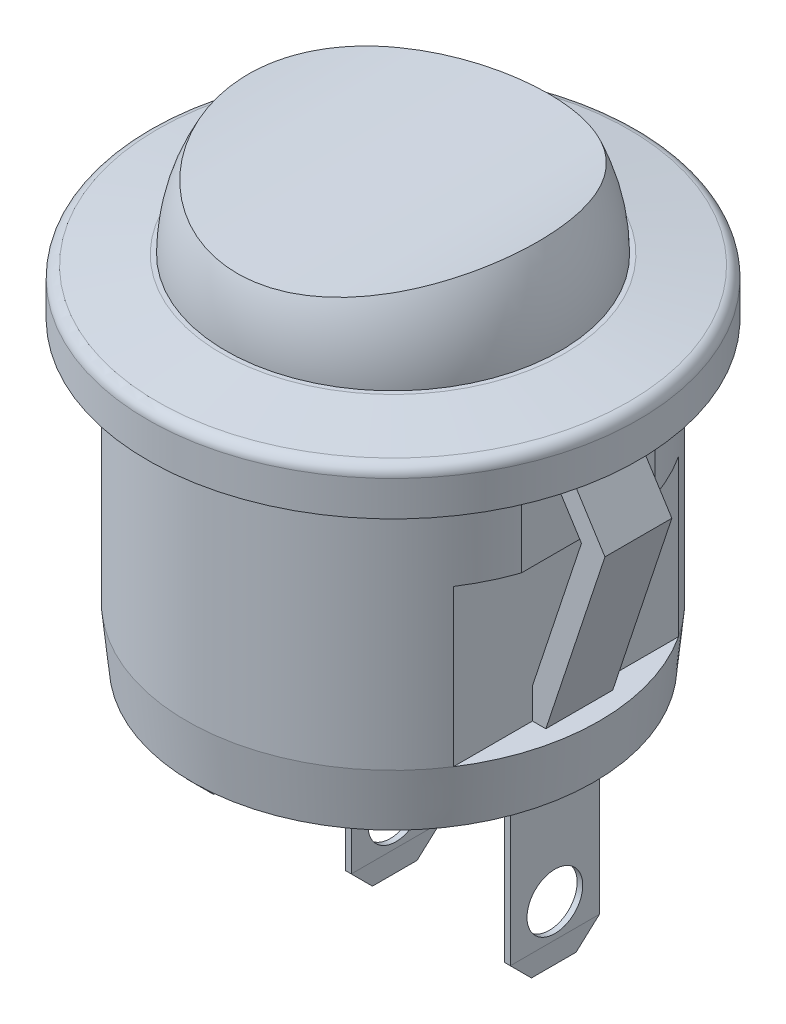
SolidWorks part; units mm, degrees
ref_plane "Front Plane" through (0, 0, 0) normal (0, 0, 1) x (1, 0, 0)
ref_plane "Top Plane" through (0, 0, 0) normal (0, 1, 0) x (1, 0, 0)
ref_plane "Right Plane" through (0, 0, 0) normal (1, 0, 0) x (0, 0, -1)
sketch "Sketch1" plane through (0, 0, 0) normal (0, 0, 1) x (1, 0, 0)
  line L0 (0, 0) -> (-9.25, 0)
  line L1 (-9.25, 0) -> (-9.25, 13.5)
  line L2 (-9.25, 13.5) -> (-11, 13.5)
  line L3 (-11, 13.5) -> (-11, 16)
  line L4 (-11, 16) -> (0, 16)
  line L5 (0, 16) -> (0, 0)
  dimension "D1" = 9.25
  dimension "D2" = 16
  dimension "D3" = 11
  dimension "D4" = 2.5
revolve "Revolve1" add sketch "Sketch1" angle 360 about L5
sketch "Sketch2" plane through (0, 0, 0) normal (0, 0, 1) x (1, 0, 0)
  line L0 (11, 16) -> (-11, 16) construction
  line L1 (11, 16) -> (-11, 16) construction
  line L2 (-7.5, 16) -> (7.5, 16) construction
  line L3 (0, 16) -> (0, 23.5) construction
  line L4 (0, 16) -> (-7.5, 16)
  line L5 (0, 23.5) -> (0, 16)
  arc A0 (0, 23.5) -> (-7.5, 16) centre (0, 16) ccw
  dimension "D1" = 15
revolve "Revolve2" add sketch "Sketch2" angle 360 about L5
sketch "Sketch3" plane through (0, 0, 0) normal (0, 0, 1) x (1, 0, 0)
  line L0 (-6.5, 19.7417) -> (6.5, 19.7417) construction
  line L3 (0, 19.7417) -> (0, 18.7417) construction
  line L4 (0, 18.7417) -> (0, 23.5)
  arc A0 (7.5, 16) -> (-7.5, 16) centre (0, 16) ccw
  arc A1 (0, 23.5) -> (-6.5, 19.7417) centre (0, 16) ccw
  arc A2 (-6.5, 19.7417) -> (0, 18.7417) centre (0, 40.3667) ccw
  point P5 (-6.5, 19.7417)
  point P6 (6.5, 19.7417)
  dimension "D2" = 13
  dimension "D3" = 1
extrude "Cut-Extrude1" cut sketch "Sketch3" against normal through all both and the other way through all
mirror "Mirror1" about plane through (0, 0, 0) normal (1, 0, 0) of "Cut-Extrude1"
chamfer "Chamfer1" distance 0.5 distance2 3.3 1 edges at (-11, 16, 0)
fillet "Fillet1" radius 0.5 1 edges at (-11, 15.5, 0)
sketch "Sketch4" plane through (0, 0, 0) normal (0, 0, 1) x (1, 0, 0)
  line L0 (9.25, 0) -> (9.25, 13.5) construction
  line L1 (-9.25, 13.5) -> (-9.25, 0) construction
  line L2 (-9.25, 0) -> (9.25, 0) construction
  line L3 (9.25, 0) -> (9.25, 13.5) construction
  line L4 (-9.25, 13.5) -> (-9.25, 0) construction
  line L5 (-9.25, 0) -> (9.25, 0) construction
  line L6 (0, 0) -> (0, 13.5) construction
  line L7 (-9.25, 13.5) -> (-8.75, 13.5)
  line L8 (-9.25, 13.5) -> (-9.25, 9.5)
  line L9 (-9.25, 9.5) -> (-8.75, 9.5)
  line L10 (-8.75, 13.5) -> (-8.75, 9.5)
  line L11 (9.25, 13.5) -> (8.75, 13.5)
  line L12 (9.25, 13.5) -> (9.25, 9.5)
  line L13 (9.25, 9.5) -> (8.75, 9.5)
  line L14 (8.75, 13.5) -> (8.75, 9.5)
  line L15 (-9.25, 9.5) -> (-7.75, 9.5)
  line L16 (-9.25, 9.5) -> (-9.25, 2.5)
  line L17 (-9.25, 2.5) -> (-7.75, 2.5)
  line L18 (-7.75, 9.5) -> (-7.75, 2.5)
  line L19 (-9.25, 13.5) -> (9.25, 13.5) construction
  line L20 (9.25, 2.5) -> (7.75, 2.5)
  line L21 (7.75, 9.5) -> (7.75, 2.5)
  line L22 (9.25, 9.5) -> (7.75, 9.5)
  line L23 (9.25, 9.5) -> (9.25, 2.5)
  dimension "D1" = 17.5
  dimension "D2" = 4
  dimension "D3" = 15.5
  dimension "D4" = 7
extrude "Cut-Extrude2" cut sketch "Sketch4" against normal through all both and the other way through all contours L8 L7 L10 L9 | L15 L18 L17 L16 | L12 L11 L14 L13 | L22 L21 L20 L23
chamfer "Chamfer2" distance 0.25 distance2 2.5 1 edges at (-9.25, 0, 0)
sketch "Sketch5" plane through (0, 0, 0) normal (0, 0, 1) x (1, 0, 0)
  line L0 (9.25, 2.5) -> (7.75, 2.5) construction
  line L1 (7.75, 9.5) -> (7.75, 2.5) construction
  line L2 (8.75, 13.5) -> (8.75, 9.5) construction
  line L3 (-11, 13.5) -> (11, 13.5) construction
  line L4 (-7.75, 2.5) -> (-9.25, 2.5) construction
  line L5 (-7.75, 9.5) -> (-7.75, 2.5) construction
  line L6 (-8.75, 13.5) -> (-8.75, 9.5) construction
  line L7 (9.25, 2.5) -> (7.75, 2.5) construction
  line L8 (7.75, 9.5) -> (7.75, 2.5) construction
  line L9 (8.75, 13.5) -> (8.75, 9.5) construction
  line L10 (-11, 13.5) -> (11, 13.5) construction
  line L11 (-7.75, 2.5) -> (-9.25, 2.5) construction
  line L12 (-7.75, 9.5) -> (-7.75, 2.5) construction
  line L13 (-8.75, 13.5) -> (-8.75, 9.5) construction
  line L14 (-8.75, 12.3893) -> (-8.75, 13.5)
  line L15 (-8.75, 13.5) -> (-9.1, 13.5)
  line L16 (-9.1, 13.5) -> (-11, 10.5)
  line L17 (-11, 10.5) -> (-8.35, 2.5)
  line L18 (-8.35, 2.5) -> (-7.75, 2.5)
  line L19 (-7.75, 2.5) -> (-7.75, 3.8689)
  line L20 (-7.75, 3.8689) -> (-9.9466, 10.5)
  line L21 (-9.9466, 10.5) -> (-8.75, 12.3893)
  line L22 (-9.9466, 10.5) -> (-11, 10.5) construction
  line L23 (-11, 13.5) -> (-11, 10.5) construction
  line L24 (-7.75, 2.5) -> (7.75, 2.5) construction
  line L25 (0, 0) -> (0, 13.5) construction
  line L26 (7.75, 3.8689) -> (9.9466, 10.5)
  line L27 (7.75, 2.5) -> (7.75, 3.8689)
  line L28 (8.35, 2.5) -> (7.75, 2.5)
  line L29 (11, 10.5) -> (8.35, 2.5)
  line L30 (9.1, 13.5) -> (11, 10.5)
  line L31 (8.75, 13.5) -> (9.1, 13.5)
  line L32 (8.75, 12.3893) -> (8.75, 13.5)
  line L33 (9.9466, 10.5) -> (8.75, 12.3893)
  dimension "D1" = 0.9
  dimension "D2" = 1.9
  dimension "D3" = 1
  dimension "D4" = 8
extrude "Boss-Extrude1" add sketch "Sketch5" along normal mid plane 3 contours L20 L21 L14 L15 L16 L17 L18 L19 | L33 L26 L27 L28 L29 L30 L31 L32
sketch "Sketch6" plane through (0, 0, 0) normal (0, -1, 0) x (1, 0, 0)
  line L0 (7.125, 0) -> (-7.125, 0) construction
  line L1 (0.125, -2) -> (-0.125, -2)
  line L2 (0.125, -2) -> (0.125, 2)
  line L3 (0.125, 2) -> (-0.125, 2)
  line L4 (-0.125, -2) -> (-0.125, 2)
  line L5 (0.125, -2) -> (-0.125, 2) construction
  line L6 (0.125, 2) -> (-0.125, -2) construction
  line L7 (7.255, -2) -> (7.005, -2)
  line L8 (7.255, -2) -> (7.255, 2)
  line L9 (7.255, 2) -> (7.005, 2)
  line L10 (7.005, -2) -> (7.005, 2)
  line L11 (7.255, -2) -> (7.005, 2) construction
  line L12 (7.255, 2) -> (7.005, -2) construction
  line L13 (0, 0) -> (7.13, 0) construction
  line L14 (-7.005, -2) -> (-7.255, -2)
  line L15 (-7.005, -2) -> (-7.005, 2)
  line L16 (-7.005, 2) -> (-7.255, 2)
  line L17 (-7.255, -2) -> (-7.255, 2)
  line L18 (-7.005, -2) -> (-7.255, 2) construction
  line L19 (-7.005, 2) -> (-7.255, -2) construction
  line L20 (0, 0) -> (-7.13, 0) construction
  point P0 (0, 0)
  point P9 (0, 0)
  point P10 (-7.13, 0)
  point P11 (7.13, 0)
  point P16 (7.13, 0)
  point P23 (-7.13, 0)
  dimension "D1" = 4
  dimension "D2" = 0.25
  dimension "D3" = 14.25
  dimension "D5" = 7.13
  dimension "D7" = 7.13
  dimension "D4" = 2
  dimension "D6" = 2
extrude "Boss-Extrude2" add sketch "Sketch6" along normal blind 8
sketch "Sketch7" plane through (0, 0, 0) normal (1, 0, 0) x (0, 0, -1)
  line L0 (0, 0) -> (0, -5.5) construction
  circle A0 centre (0, -5.5) radius 1.25
  dimension "D1" = 2.5
  dimension "D2" = 5.5
extrude "Cut-Extrude3" cut sketch "Sketch7" against normal through all both and the other way through all
chamfer "Chamfer3" distance 1 angle 45 6 edges at (-7.13, -8, -2) (7.13, -8, -2) (0, -8, -2) (-7.13, -8, 2) (7.13, -8, 2) (0, -8, 2)
chamfer "Chamfer4" distance 1 distance2 0.05 4 edges at (7.255, -8, 0) (0.125, -8, 0) (-7.13, -8, -1) (-7.005, -8, 0)
